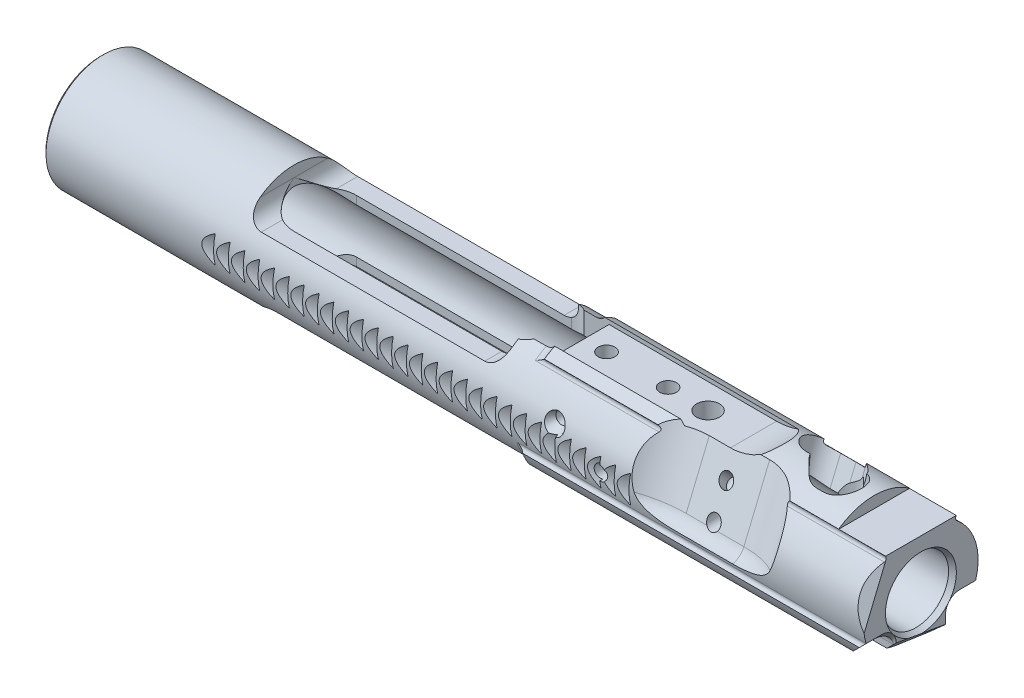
SolidWorks part; units mm, degrees
ref_plane "Front Plane" through (0, 0, 0) normal (0, 0, 1) x (1, 0, 0)
ref_plane "Top Plane" through (0, 0, 0) normal (0, 1, 0) x (1, 0, 0)
ref_plane "Right Plane" through (0, 0, 0) normal (1, 0, 0) x (0, 0, -1)
sketch "Sketch1" plane through (0, 0, 0) normal (1, 0, 0) x (0, 0, -1)
  circle A0 centre (0, 0) radius 11.7983
  dimension "D1" = 23.5966
extrude "Boss-Extrude1" add sketch "Sketch1" against normal blind 169.164
sketch "Sketch2" plane through (-169.164, 0, 0) normal (-1, 0, 0) x (0, 0, 1)
  circle A0 centre (0, 0) radius 7.9375
  dimension "D1" = 15.875
extrude "Cut-Extrude1" cut sketch "Sketch2" against normal blind 97.917
fillet "Fillet1" radius 1.5875 1 edges at (-71.247, 0, 7.9375)
sketch "Sketch3" plane through (0, 0, 0) normal (0, 0, 1) x (1, 0, 0)
  line L0 (-80.01, 6.35) -> (-126.111, 6.35)
  line L1 (-129.286, 9.525) -> (-129.286, 11.7983)
  line L2 (0, 11.7983) -> (-169.164, 11.7983) construction
  line L3 (-129.286, 11.7983) -> (-76.835, 11.7983)
  line L4 (-76.835, 11.7983) -> (-76.835, 9.525)
  line L5 (-169.164, 11.7983) -> (-169.164, -11.7983) construction
  line L6 (-169.164, -11.7983) -> (0, -11.7983) construction
  line L7 (-122.3462, -6.35) -> (-71.298, -6.35)
  line L8 (-71.298, -6.35) -> (-71.298, -11.7983)
  line L9 (-71.298, -11.7983) -> (-129.286, -11.7983)
  arc A0 (-126.111, 6.35) -> (-129.286, 9.525) centre (-126.111, 9.525) cw
  arc A1 (-80.01, 6.35) -> (-76.835, 9.525) centre (-80.01, 9.525) ccw
  arc A2 (-122.3462, -6.35) -> (-129.286, -11.7983) centre (-122.3462, -13.494) ccw
  dimension "D4" = 3.175
  dimension "D7" = 14.288
  dimension "D1" = 6.35
  dimension "D2" = 39.878
  dimension "D3" = 52.451
  dimension "D6" = 6.35
  dimension "D8" = 97.866
extrude "Cut-Extrude2" cut sketch "Sketch3" against normal mid plane 30
sketch "Sketch4" plane through (0, 6.35, 0) normal (0, 1, 0) x (1, 0, 0)
  line L0 (-136.4041, 0) -> (-71.6825, 0) construction
  line L1 (-129.286, -6.9623) -> (-129.286, 6.9623) construction
  line L3 (-122.8545, 6.4315) -> (-78.473, 6.4315)
  line L4 (-122.8545, -6.4315) -> (-78.473, -6.4315)
  line L5 (-169.164, 11.7983) -> (-169.164, -11.7983) construction
  arc A0 (-122.8545, 6.4315) -> (-122.8545, -6.4315) centre (-122.8545, 0) ccw
  arc A1 (-78.473, -6.4315) -> (-78.473, 6.4315) centre (-78.473, 0) ccw
  dimension "D1" = 12.863
  dimension "D2" = 12.863
  dimension "D3" = 90.691
extrude "Cut-Extrude3" cut sketch "Sketch4" against normal up to next and the other way up to next
sketch "Sketch5" plane through (0, -6.35, 0) normal (0, -1, 0) x (1, 0, 0)
  line L0 (-169.164, 0) -> (-116.3804, 0) construction
  line L1 (-169.164, 11.7983) -> (-169.164, -11.7983) construction
  line L2 (-129.286, 0) -> (-129.286, 4.226) construction
  line L3 (-122.8545, 6.4315) -> (-78.1436, 6.4315)
  line L4 (-78.1436, 6.4315) -> (-78.1436, -6.4315)
  line L5 (-78.1436, -6.4315) -> (-122.8545, -6.4315)
  arc A0 (-122.8545, 6.4315) -> (-122.8545, -6.4315) centre (-122.8545, 0) ccw
  spline S0 degree 3 poles (-122.3462, 9.9437) (-122.9959, 9.9437) (-123.6281, 9.8897) (-124.5504, 9.718) (-124.8481, 9.646) (-125.4159, 9.4721) (-125.6874, 9.3698) (-126.2059, 9.1303) (-126.4505, 8.9936) (-126.9004, 8.6908) (-127.1077, 8.5238) (-127.4897, 8.1561) (-127.6639, 7.9553) (-127.9739, 7.5305) (-128.1113, 7.3052) (-128.3563, 6.8285) (-128.4643, 6.5758) (-128.6514, 6.0562) (-128.7312, 5.7883) (-128.8695, 5.2369) (-128.9279, 4.9535) (-129.0282, 4.3715) (-129.0701, 4.0716) (-129.1752, 3.1611) (-129.2184, 2.5411) (-129.274, 1.2768) (-129.2861, 0.6287) (-129.2859, -0.6503) (-129.2737, -1.2858) (-129.2318, -2.233) (-129.2137, -2.5489) (-129.1671, -3.1727) (-129.1387, -3.4788) (-129.0343, -4.3794) (-128.9395, -4.9566) (-128.7322, -5.7849) (-128.6515, -6.056) (-128.4633, -6.5786) (-128.3566, -6.8279) (-128.1128, -7.3025) (-127.9758, -7.5278) (-127.665, -7.9541) (-127.4902, -8.1555) (-126.9207, -8.7042) (-126.4769, -9.004) (-125.4341, -9.4879) (-124.8667, -9.6584) (-123.9464, -9.8308) (-123.6295, -9.8735) (-122.9934, -9.9297) (-122.6716, -9.9437) (-122.3462, -9.9437) knots 0 0 0 0 0.0625 0.0625 0.09375 0.09375 0.125 0.125 0.15625 0.15625 0.1875 0.1875 0.21875 0.21875 0.25 0.25 0.28125 0.28125 0.3125 0.3125 0.34375 0.34375 0.375 0.375 0.4375 0.4375 0.5 0.5 0.5625 0.5625 0.59375 0.59375 0.625 0.625 0.6875 0.6875 0.71875 0.71875 0.75 0.75 0.78125 0.78125 0.8125 0.8125 0.875 0.875 0.9375 0.9375 0.96875 0.96875 1 1 1 1 construction
  dimension "D2" = 12.863
extrude "Cut-Extrude4" cut sketch "Sketch5" against normal up to next and the other way up to next
sketch "Sketch6" plane through (-169.164, 0, 0) normal (-1, 0, 0) x (0, 0, 1)
  line L0 (0, 0) -> (0, -11.7983) construction
  line L1 (-1.9939, -8.8159) -> (1.9939, -8.8159)
  line L2 (-1.9939, -8.8159) -> (-1.9939, -10.9859)
  line L3 (-1.9939, -13.3258) -> (1.9939, -13.3258)
  line L4 (1.9939, -10.9859) -> (1.9939, -8.8159)
  line L5 (-1.9939, -10.9859) -> (-2.9111, -11.9031)
  line L6 (-2.9111, -11.9031) -> (-2.9111, -13.3258)
  line L7 (-2.9111, -13.3258) -> (-1.9939, -13.3258)
  line L8 (1.9939, -10.9859) -> (2.9111, -11.9031)
  line L9 (2.9111, -11.9031) -> (2.9111, -13.3258)
  line L10 (2.9111, -13.3258) -> (1.9939, -13.3258)
  circle A0 centre (0, 0) radius 11.7983 construction
  point P9 (0, -8.8159)
  dimension "D1" = 8.8159
  dimension "D2" = 3.9878
  dimension "D3" = 2.17
extrude "Cut-Extrude5" cut sketch "Sketch6" against normal up to next
chamfer "Chamfer1" distance 0.508 1 edges at (-169.164, 11.7983, 0)
sketch "Sketch9" plane through (0, 0, 0) normal (0, 0, 1) x (1, 0, 0)
  line L0 (0, 0) -> (-71.247, 0) construction
  line L1 (-71.247, 6.35) -> (-71.247, -6.35) construction
  line L2 (-1.016, 6.731) -> (-29.845, 6.731)
  line L3 (-1.016, 6.731) -> (0, 7.3176)
  line L4 (0, -11.7983) -> (0, 11.7983) construction
  line L5 (-30.5049, 6.35) -> (-42.634, 6.35)
  line L6 (-30.5049, 6.35) -> (-29.845, 6.731)
  line L7 (-45.174, 6.35) -> (-46.863, 6.35)
  line L8 (-46.863, 6.35) -> (-46.863, 3.1877)
  line L9 (-46.863, 3.1877) -> (-49.6062, 3.1877)
  line L10 (-49.6062, 3.1877) -> (-49.6062, 3.7465)
  line L11 (-49.6062, 3.7465) -> (-57.4, 3.7465)
  line L12 (-57.4, 3.7465) -> (-57.4, 5.588)
  line L13 (-57.4, 5.588) -> (-71.247, 5.588)
  line L14 (-71.247, 5.588) -> (-71.247, 0)
  line L15 (0, 7.3176) -> (0, 0)
  line L16 (0, 0) -> (-71.247, 0)
  arc A0 (-42.634, 6.35) -> (-45.174, 6.35) centre (-43.904, 6.35) ccw
  dimension "D8" = 2.54
  dimension "D9" = 2.959
  dimension "D1" = 13.462
  dimension "D2" = 30
  dimension "D3" = 1.016
  dimension "D4" = 29.845
  dimension "D5" = 12.7
  dimension "D6" = 30
  dimension "D7" = 46.863
  dimension "D10" = 6.3754
  dimension "D11" = 2.7432
  dimension "D12" = 7.493
  dimension "D13" = 57.4
  dimension "D14" = 11.176
revolve "Cut-Revolve1" cut sketch "Sketch9" angle 360 about L0
sketch "Sketch12" plane through (0, 0, 0) normal (1, 0, 0) x (0, 0, -1)
  line L0 (0, 0) -> (0, 12.5603) construction
  line L1 (0, 0) -> (-7.9164, 9.7515) construction
  line L2 (0, 0) -> (-12.0179, -3.6513) construction
  arc A1 (-11.7743, -4.3733) -> (11.7743, -4.3733) centre (0, 0) ccw
  arc A2 (-11.2888, -3.4298) -> (11.2888, -3.4298) centre (0, 0) ccw
  arc A3 (-7.4361, 9.1599) -> (-7.3105, 10.2136) centre (-7.9164, 9.7515) ccw
  arc A4 (-11.7743, -4.3733) -> (-11.2888, -3.4298) centre (-12.0179, -3.6513) ccw
  circle A5 centre (0, 0) radius 11.7983 construction
  arc A6 (11.7743, -4.3733) -> (11.2888, -3.4298) centre (12.0179, -3.6513) cw
  arc A7 (7.4361, 9.1599) -> (7.3105, 10.2136) centre (7.9164, 9.7515) cw
  arc A8 (7.3105, 10.2136) -> (-7.3105, 10.2136) centre (0, 0) ccw
  arc A9 (7.4361, 9.1599) -> (-7.4361, 9.1599) centre (0, 0) ccw
  dimension "D3" = 1.524
  dimension "D1" = 39.07
  dimension "D2" = 106.9
extrude "Boss-Extrude2" add sketch "Sketch12" against normal blind 72.0921
sketch "Sketch13" plane through (0, 0, 0) normal (0, 0, 1) x (1, 0, 0)
  line L0 (0, 12.5603) -> (-70.358, 12.5603) construction
  line L1 (0, 12.5603) -> (-72.0921, 12.5603) construction
  line L3 (-129.286, 11.7983) -> (-72.0921, 11.7983) construction
  line L4 (0, 0) -> (-62.44, 0) construction
  line L6 (-129.286, 9.525) -> (-129.286, 11.7983) construction
  circle A0 centre (-72.0921, 14.1525) radius 2.3542
  dimension "D1" = 70.358
revolve "Cut-Revolve2" cut sketch "Sketch13" angle 360 about L4
sketch "Sketch10" plane through (0, 0, 0) normal (0, 0, 1) x (1, 0, 0)
  line L0 (-34.925, 10.617) -> (-69.4692, 10.617)
  line L1 (-75.782, 17.653) -> (-47.625, 23.317)
  arc A0 (-75.782, 17.653) -> (-69.4692, 10.617) centre (-75.782, 11.303) ccw
  arc A1 (-34.925, 10.617) -> (-47.625, 23.317) centre (-34.925, 23.317) ccw
  dimension "D1" = 12.7
  dimension "D4" = 25.4
  dimension "D2" = 75.782
  dimension "D3" = 11.303
  dimension "D5" = 23.317
  dimension "D6" = 34.925
extrude "Cut-Extrude8" cut sketch "Sketch10" against normal mid plane 10.3124
sketch "Sketch14" plane through (0, 0, 0) normal (1, 0, 0) x (0, 0, -1)
  line L0 (-7.29, 10.1854) -> (7.29, 10.1854)
  arc A0 (7.3105, 10.2136) -> (-7.3105, 10.2136) centre (0, 0) ccw construction
  arc A1 (7.3105, 10.2136) -> (-7.3105, 10.2136) centre (0, 0) ccw
  arc A2 (-7.4361, 9.1599) -> (-7.3105, 10.2136) centre (-7.9164, 9.7515) ccw construction
  arc A3 (-7.29, 10.1854) -> (-7.3105, 10.2136) centre (-7.9164, 9.7515) ccw
  arc A4 (7.3105, 10.2136) -> (7.4361, 9.1599) centre (7.9164, 9.7515) ccw construction
  arc A5 (7.3105, 10.2136) -> (7.29, 10.1854) centre (7.9164, 9.7515) ccw
  dimension "D1" = 10.1854
extrude "Cut-Extrude9" cut sketch "Sketch14" against normal blind 9.652
sketch "Sketch15" plane through (0, 0, 0) normal (1, 0, 0) x (0, 0, -1)
  line L0 (0, 0) -> (0, -12.5603) construction
  line L1 (0, 0) -> (-7.0649, -6.9865) construction
  line L2 (-8.1505, -5.3252) -> (-10.5149, -6.8701)
  line L3 (2.858, -9.246) -> (-2.858, -9.246)
  line L4 (-5.0804, -6.9865) -> (-5.0804, -8.3254)
  line L5 (-5.0804, -8.3254) -> (-2.858, -9.246)
  line L6 (5.0804, -8.3254) -> (2.858, -9.246)
  line L7 (5.0804, -6.9865) -> (5.0804, -8.3254)
  line L8 (8.1505, -5.3252) -> (10.5149, -6.8701)
  arc A0 (-11.7743, -4.3733) -> (11.7743, -4.3733) centre (0, 0) ccw construction
  arc A1 (-5.0804, -6.9865) -> (-8.1505, -5.3252) centre (-7.0649, -6.9865) ccw
  arc A2 (-10.5149, -6.8701) -> (10.5149, -6.8701) centre (0, 0) ccw
  arc A3 (5.0804, -6.9865) -> (8.1505, -5.3252) centre (7.0649, -6.9865) cw
  point P15 (0, -9.246)
  dimension "D3" = 3.969
  dimension "D1" = 45.32
  dimension "D2" = 9.936
  dimension "D4" = 5.0804
  dimension "D5" = 2.858
  dimension "D6" = 22.5
  dimension "D7" = 9.246
extrude "Cut-Extrude10" cut sketch "Sketch15" against normal blind 71.2978
sketch "Sketch17" plane through (0, 0, 0) normal (1, 0, 0) x (0, 0, -1)
  line L0 (-2.2866, -6.35) -> (-9.9437, -6.35) construction
  line L1 (9.9437, -6.35) -> (2.2866, -6.35) construction
  line L3 (-5.0804, -8.3254) -> (-5.0804, -6.9865) construction
  line L4 (-2.858, -9.246) -> (-5.0804, -8.3254) construction
  line L5 (2.858, -9.246) -> (-2.858, -9.246) construction
  line L6 (5.0804, -8.3254) -> (2.858, -9.246) construction
  line L7 (5.0804, -6.9865) -> (5.0804, -8.3254) construction
  line L9 (-5.1853, -6.35) -> (-9.7188, -6.35)
  line L10 (9.7188, -6.35) -> (5.1853, -6.35)
  line L12 (-5.0804, -8.3254) -> (-5.0804, -6.9865)
  line L13 (-2.858, -9.246) -> (-5.0804, -8.3254)
  line L14 (2.858, -9.246) -> (-2.858, -9.246)
  line L15 (5.0804, -8.3254) -> (2.858, -9.246)
  line L16 (5.0804, -6.9865) -> (5.0804, -8.3254)
  line L17 (-8.1505, -5.3252) -> (-10.5149, -6.8701) construction
  line L18 (-9.7188, -6.35) -> (-9.9925, -6.5288)
  line L19 (9.9925, -6.5288) -> (8.1505, -5.3252) construction
  line L20 (9.9925, -6.5288) -> (9.7188, -6.35)
  arc A0 (-5.0804, -6.9865) -> (-8.1505, -5.3252) centre (-7.0649, -6.9865) ccw construction
  arc A1 (8.1505, -5.3252) -> (5.0804, -6.9865) centre (7.0649, -6.9865) ccw construction
  arc A2 (-9.9925, -6.5288) -> (9.9925, -6.5288) centre (0, 0) ccw construction
  arc A3 (-5.0804, -6.9865) -> (-5.1853, -6.35) centre (-7.0649, -6.9865) ccw
  arc A4 (5.1853, -6.35) -> (5.0804, -6.9865) centre (7.0649, -6.9865) ccw
  arc A5 (-9.9925, -6.5288) -> (9.9925, -6.5288) centre (0, 0) ccw
extrude "Cut-Extrude11" cut sketch "Sketch17" against normal blind 81.2978
sketch "Sketch18" plane through (-71.2978, 0, 0) normal (1, 0, 0) x (0, 0, -1)
  line L2 (5.1853, -6.35) -> (9.7188, -6.35)
  line L3 (9.7188, -6.35) -> (8.1505, -5.3252)
  line L4 (5.1853, -6.35) -> (9.7188, -6.35)
  line L5 (9.7188, -6.35) -> (8.1505, -5.3252)
  arc A3 (8.1505, -5.3252) -> (5.1853, -6.35) centre (7.0649, -6.9865) ccw
  arc A5 (8.1505, -5.3252) -> (5.1853, -6.35) centre (7.0649, -6.9865) ccw
  dimension "D1" = 0
ref_plane "Plane1" through (0, 0, -7.0649) normal (0, 0, 1) x (1, 0, 0)
sketch "Sketch19" plane through (0, 0, -7.0649) normal (0, 0, 1) x (1, 0, 0)
  line L0 (-71.2978, -49.6068) -> (-71.2978, -5.002) construction
  line L1 (-71.2978, -49.6068) -> (-94.0311, -11.2298) construction
  arc A0 (-71.2978, -5.002) -> (-94.0311, -11.2298) centre (-71.2978, -49.6068) ccw
  dimension "D1" = 89.2097
sweep "Cut-Sweep1" cut profiles "Sketch18" path "Sketch19"
mirror "Mirror1" about plane through (0, 0, 0) normal (0, 0, 1) of "Cut-Sweep1"
sketch "Sketch20" plane through (0, 0, 0) normal (0, 0, 1) x (1, 0, 0)
  line L0 (-72.0921, -6.35) -> (-122.3462, -6.35) construction
  line L1 (-71.298, -9.246) -> (-73.2608, -9.246)
  line L2 (-71.298, -9.246) -> (-71.298, -6.35)
  line L3 (-71.298, -6.35) -> (-73.2608, -6.35)
  line L4 (-73.2608, -9.246) -> (-73.2608, -6.35)
extrude "Cut-Extrude12" cut sketch "Sketch20" against normal up to next and the other way up to next
sketch "Sketch22" plane through (0, 0, 0) normal (0, 1, 0) x (1, 0, 0)
  line L0 (-118.1731, 0) -> (-60.3792, 0) construction
  line L1 (-71.247, 5.588) -> (-71.247, -5.588) construction
  line L2 (-71.247, 5.583) -> (-71.247, -5.583)
  line L3 (-78.4735, -6.4315) -> (-73.0446, -7.1565)
  line L4 (-78.1436, -6.4315) -> (-81.7584, -6.4315) construction
  line L5 (-78.4735, -6.4315) -> (-78.4735, 6.4315)
  line L6 (-78.4735, 6.4315) -> (-73.0446, 7.1565)
  arc A0 (-73.0446, -7.1565) -> (-71.247, -5.583) centre (-72.8345, -5.583) ccw
  arc A1 (-73.0446, 7.1565) -> (-71.247, 5.583) centre (-72.8345, 5.583) cw
  point P13 (-71.247, 0)
  point P17 (-78.4735, 0)
  dimension "D1" = 3.175
  dimension "D2" = 5.583
  dimension "D3" = 5.639
extrude "Cut-Extrude13" cut sketch "Sketch22" against normal up to surface (6.35 mm away)
sketch "Sketch24" plane through (0, 0, 0) normal (0, 0, 1) x (1, 0, 0)
  line L0 (-43.307, -9.246) -> (-71.298, -8.3254)
  line L1 (-71.298, -8.3254) -> (-71.298, -9.246)
  line L2 (-71.298, -9.246) -> (-43.307, -9.246)
  line L3 (-71.298, -9.246) -> (0, -9.246) construction
  line L4 (-71.298, -8.3254) -> (-71.298, -6.9865) construction
  dimension "D2" = 43.307
extrude "Cut-Extrude15" cut sketch "Sketch24" against normal up to next and the other way up to next
sketch "Sketch25" plane through (0, 0, 0) normal (1, 0, 0) x (0, 0, -1)
  line L0 (-11.2887, -3.43) -> (11.2887, -3.43) construction
  arc A0 (-7.4361, 9.1599) -> (-11.2888, -3.4298) centre (0, 0) ccw construction
  arc A1 (11.2888, -3.4298) -> (7.4361, 9.1599) centre (0, 0) ccw construction
  dimension "D1" = 3.43
ref_plane "Plane2" through (-1.715, -1.715, 0) normal (0.7071, 0.7071, 0) x (-0.7071, 0.7071, 0)
sketch "Sketch27" plane through (-1.715, -1.715, 0) normal (0.7071, 0.7071, 0) x (-0.7071, 0.7071, 0)
  line L0 (-2.4254, 11.2887) -> (-2.4254, -11.2887) construction
  line L1 (-4.9402, -5.0804) -> (-5.887, -5.0804) construction
  line L2 (-4.5319, -5.0804) -> (-5.7795, -5.0804)
  line L3 (-2.4254, -8.059) -> (-2.4254, -11.7743)
  line L4 (46.6582, -11.7743) -> (-3.0924, -11.7743) construction
  line L5 (-2.4254, -11.7743) -> (-6.6384, -11.7743)
  line L6 (-6.6384, -11.7743) -> (-6.6384, -5.0804)
  line L7 (0, 0) -> (-14.9346, 0) construction
  line L8 (-2.4254, 11.7743) -> (-6.6384, 11.7743)
  line L9 (-2.4254, 8.059) -> (-2.4254, 11.7743)
  line L11 (-6.6384, 11.7743) -> (-6.6384, 5.0804)
  line L12 (-4.5319, 5.0804) -> (-5.7795, -5.0804)
  line L13 (-6.6384, 5.0804) -> (-6.6384, -5.0804)
  ellipse E0 centre (-4.5319, -8.059) end of major axis (-4.5319, -5.0804) minor radius 2.1065 (-2.4254, -8.059) -> (-4.5319, -5.0804) ccw
  ellipse E1 centre (-4.5319, 8.059) end of major axis (-4.5319, 5.0804) minor radius 2.1065 (-2.4254, 8.059) -> (-4.5319, 5.0804) cw
  dimension "D1" = 8.059
  dimension "D2" = 4.213
  dimension "D3" = 7
extrude "Cut-Extrude17" cut sketch "Sketch27" against normal blind 8.3566
sketch "Sketch28" plane through (0, 0, 0) normal (1, 0, 0) x (0, 0, -1)
  line L0 (0, 0) -> (0, 9.2596) construction
  line L1 (-12.197, -2.5741) -> (-7.2124, 9.4599)
  arc A0 (-7.4361, 9.1599) -> (-7.29, 10.1854) centre (-7.9164, 9.7515) ccw construction
  dimension "D1" = 22.5
ref_plane "Plane3" through (0, 9.4599, 0) normal (0, 1, 0) x (-1, 0, 0)
sketch "Sketch31" plane through (0, 9.4599, 0) normal (0, 1, 0) x (-1, 0, 0)
  line L0 (0, 7.2124) -> (5, 12.2124)
  line L1 (5, 12.2124) -> (0, 12.2124)
  line L2 (0, 12.2124) -> (0, 7.2124)
  dimension "D1" = 45
  dimension "D2" = 5
sweep "Cut-Sweep2" cut profiles "Sketch31" path "Sketch28"
ref_plane "Plane4" through (-27.388, 0, 0) normal (1, 0, 0) x (0, 0, -1)
sketch "Sketch32" plane through (-27.388, 0, 0) normal (1, 0, 0) x (0, 0, -1)
  line L0 (-9.1211, -0.891) -> (-3.7922, 11.9742)
  line L1 (0, 0) -> (0, 9.0623) construction
  line L2 (-9.1211, -0.891) -> (-14.1082, 1.1747) construction
  line L3 (-12.0544, 0.324) -> (-13.2694, -2.6093) construction
  arc A0 (-13.2694, -2.6093) -> (-9.1211, -0.891) centre (-12.0544, 0.324) ccw
  arc A1 (7.3105, 10.2136) -> (-7.3105, 10.2136) centre (0, 0) ccw construction
  arc A2 (7.3105, 10.2136) -> (-7.3105, 10.2136) centre (0, 0) ccw construction
  dimension "D4" = 6.35
  dimension "D1" = 22.5
  dimension "D2" = 9.1211
  dimension "D3" = 0.891
ref_plane "Plane5" through (-27.388, 11.9742, 3.7922) normal (0, 0.9239, -0.3827) x (-1, 0, 0)
sketch "Sketch33" plane through (-27.388, 11.9742, 3.7922) normal (0, 0.9239, -0.3827) x (-1, 0, 0)
  line L0 (0, 0) -> (11.899, 0)
  line L1 (-8.9803, 3.7197) -> (20.8793, 3.7197)
  arc A0 (-8.9803, 3.7197) -> (0, 0) centre (0, 12.7) ccw
  arc A1 (11.899, 0) -> (20.8793, 3.7197) centre (11.899, 12.7) ccw
  dimension "D1" = 25.4
  dimension "D2" = 25.4
  dimension "D3" = 11.899
sweep "Cut-Sweep4" cut profiles "Sketch33" path "Sketch32"
fillet "Fillet2" radius 2 1 edges at (-71.298, -8.3254, 0)
sketch "Sketch34" plane through (0, 10.617, 0) normal (0, 1, 0) x (1, 0, 0)
  line L0 (0, 0) -> (-69.4692, 0) construction
  line L1 (-69.4692, 5.1562) -> (-69.4692, -5.1562) construction
  circle A0 centre (-43.9039, 0) radius 2.3749
  dimension "D1" = 4.7498
  dimension "D2" = 43.9039
extrude "Cut-Extrude18" cut sketch "Sketch34" against normal up to next
ref_plane "Plane6" through (-64.2747, 0, 0) normal (1, 0, 0) x (0, 0, -1)
sketch "Sketch35" plane through (-64.2747, 0, 0) normal (1, 0, 0) x (0, 0, -1)
  line L0 (0, 0) -> (0, 10.617) construction
  line L2 (-11.8825, 3.9692) -> (11.8825, 3.9692) construction
  line L3 (5.1562, 10.617) -> (-5.1562, 10.617) construction
  line L4 (-9.7907, 5.2011) -> (0, 5.2011)
  line L5 (-9.7907, 5.2011) -> (-11.8825, 6.4088)
  line L6 (-11.8825, 3.9692) -> (-11.8825, 6.4088)
  line L7 (0, 5.2011) -> (6.6656, 5.2011)
  line L8 (6.6656, 5.2011) -> (10.7351, 7.5506)
  line L9 (11.8825, 7.5506) -> (11.8825, 3.9692)
  line L10 (10.7351, 7.5506) -> (11.8825, 7.5506)
  line L11 (11.8825, 3.9692) -> (-11.8825, 3.9692)
  point P10 (0, 3.9692)
  dimension "D1" = 6.6478
  dimension "D2" = 2.4638
  dimension "D3" = 9.7907
  dimension "D4" = 30
  dimension "D5" = 30
  dimension "D6" = 6.6656
  dimension "D7" = 7.1628
revolve "Cut-Revolve3" cut sketch "Sketch35" angle 360 about L11
sketch "Sketch36" plane through (0, 0, 0) normal (0, 0, 1) x (1, 0, 0)
  circle A0 centre (-54.5211, 0) radius 1.4351
  circle A1 centre (-33.9344, 0) radius 1.397
  dimension "D1" = 2.8702
  dimension "D2" = 54.5211
  dimension "D3" = 2.794
  dimension "D4" = 33.9344
extrude "Cut-Extrude19" cut sketch "Sketch36" along normal up to next
ref_plane "Plane7" through (-33.9344, 0, 0) normal (1, 0, 0) x (0, 0, -1)
sketch "Sketch37" plane through (-33.9344, 0, 0) normal (1, 0, 0) x (0, 0, -1)
  line L0 (0, 0) -> (-8.0365, 0) construction
  line L1 (0, 0) -> (-7.7756, 7.7756) construction
  line L2 (-7.7756, 7.7756) -> (-6.7878, 8.7634)
  line L3 (-6.7878, 8.7634) -> (-2.0988, 4.0744)
  line L4 (-2.0988, 4.0744) -> (-3.0866, 3.0866)
  line L5 (-7.7756, 7.7756) -> (-3.0866, 3.0866)
  dimension "D1" = 45
  dimension "D2" = 2.794
revolve "Cut-Revolve4" cut sketch "Sketch37" angle 360 about L1
sketch "Sketch38" plane through (0, 0, 0) normal (0, 1, 0) x (1, 0, 0)
  line L0 (0, 0) -> (-126.9169, 0) construction
  line L1 (-136.5261, -18.8523) -> (-134.0988, -18.8523)
  line L2 (0, -18.8523) -> (-162.5946, -18.8523) construction
  line L3 (-136.5261, -18.8523) -> (-136.5261, -11.7983)
  line L4 (-134.0988, -18.8523) -> (-134.0988, -10.9148)
  line L5 (-134.0988, -10.9148) -> (-136.5261, -11.7983)
  line L6 (-133.4661, -18.8523) -> (-133.4661, -11.7983)
  line L7 (-131.0388, -10.9148) -> (-133.4661, -11.7983)
  line L8 (-131.0388, -18.8523) -> (-131.0388, -10.9148)
  line L9 (-133.4661, -18.8523) -> (-131.0388, -18.8523)
  line L10 (-130.4061, -18.8523) -> (-130.4061, -11.7983)
  line L11 (-127.9788, -10.9148) -> (-130.4061, -11.7983)
  line L12 (-127.9788, -18.8523) -> (-127.9788, -10.9148)
  line L13 (-130.4061, -18.8523) -> (-127.9788, -18.8523)
  line L14 (-127.3461, -18.8523) -> (-127.3461, -11.7983)
  line L15 (-124.9188, -10.9148) -> (-127.3461, -11.7983)
  line L16 (-124.9188, -18.8523) -> (-124.9188, -10.9148)
  line L17 (-127.3461, -18.8523) -> (-124.9188, -18.8523)
  line L18 (-124.2861, -18.8523) -> (-124.2861, -11.7983)
  line L19 (-121.8588, -10.9148) -> (-124.2861, -11.7983)
  line L20 (-121.8588, -18.8523) -> (-121.8588, -10.9148)
  line L21 (-124.2861, -18.8523) -> (-121.8588, -18.8523)
  line L22 (-121.2261, -18.8523) -> (-121.2261, -11.7983)
  line L23 (-118.7988, -10.9148) -> (-121.2261, -11.7983)
  line L24 (-118.7988, -18.8523) -> (-118.7988, -10.9148)
  line L25 (-121.2261, -18.8523) -> (-118.7988, -18.8523)
  line L26 (-118.1661, -18.8523) -> (-118.1661, -11.7983)
  line L27 (-115.7388, -10.9148) -> (-118.1661, -11.7983)
  line L28 (-115.7388, -18.8523) -> (-115.7388, -10.9148)
  line L29 (-118.1661, -18.8523) -> (-115.7388, -18.8523)
  line L30 (-115.1061, -18.8523) -> (-115.1061, -11.7983)
  line L31 (-112.6788, -10.9148) -> (-115.1061, -11.7983)
  line L32 (-112.6788, -18.8523) -> (-112.6788, -10.9148)
  line L33 (-115.1061, -18.8523) -> (-112.6788, -18.8523)
  line L34 (-112.0461, -18.8523) -> (-112.0461, -11.7983)
  line L35 (-109.6188, -10.9148) -> (-112.0461, -11.7983)
  line L36 (-109.6188, -18.8523) -> (-109.6188, -10.9148)
  line L37 (-112.0461, -18.8523) -> (-109.6188, -18.8523)
  line L38 (-108.9861, -18.8523) -> (-108.9861, -11.7983)
  line L39 (-106.5588, -10.9148) -> (-108.9861, -11.7983)
  line L40 (-106.5588, -18.8523) -> (-106.5588, -10.9148)
  line L41 (-108.9861, -18.8523) -> (-106.5588, -18.8523)
  line L42 (-105.9261, -18.8523) -> (-105.9261, -11.7983)
  line L43 (-103.4988, -10.9148) -> (-105.9261, -11.7983)
  line L44 (-103.4988, -18.8523) -> (-103.4988, -10.9148)
  line L45 (-105.9261, -18.8523) -> (-103.4988, -18.8523)
  line L46 (-102.8661, -18.8523) -> (-102.8661, -11.7983)
  line L47 (-100.4388, -10.9148) -> (-102.8661, -11.7983)
  line L48 (-100.4388, -18.8523) -> (-100.4388, -10.9148)
  line L49 (-102.8661, -18.8523) -> (-100.4388, -18.8523)
  line L50 (-99.8061, -18.8523) -> (-99.8061, -11.7983)
  line L51 (-97.3788, -10.9148) -> (-99.8061, -11.7983)
  line L52 (-97.3788, -18.8523) -> (-97.3788, -10.9148)
  line L53 (-99.8061, -18.8523) -> (-97.3788, -18.8523)
  line L54 (-96.7461, -18.8523) -> (-96.7461, -11.7983)
  line L55 (-94.3188, -10.9148) -> (-96.7461, -11.7983)
  line L56 (-94.3188, -18.8523) -> (-94.3188, -10.9148)
  line L57 (-96.7461, -18.8523) -> (-94.3188, -18.8523)
  line L58 (-93.6861, -18.8523) -> (-93.6861, -11.7983)
  line L59 (-91.2588, -10.9148) -> (-93.6861, -11.7983)
  line L60 (-91.2588, -18.8523) -> (-91.2588, -10.9148)
  line L61 (-93.6861, -18.8523) -> (-91.2588, -18.8523)
  line L62 (-90.6261, -18.8523) -> (-90.6261, -11.7983)
  line L63 (-88.1988, -10.9148) -> (-90.6261, -11.7983)
  line L64 (-88.1988, -18.8523) -> (-88.1988, -10.9148)
  line L65 (-90.6261, -18.8523) -> (-88.1988, -18.8523)
  line L66 (-87.5661, -18.8523) -> (-87.5661, -11.7983)
  line L67 (-85.1388, -10.9148) -> (-87.5661, -11.7983)
  line L68 (-85.1388, -18.8523) -> (-85.1388, -10.9148)
  line L69 (-87.5661, -18.8523) -> (-85.1388, -18.8523)
  line L70 (-84.5061, -18.8523) -> (-84.5061, -11.7983)
  line L71 (-82.0788, -10.9148) -> (-84.5061, -11.7983)
  line L72 (-82.0788, -18.8523) -> (-82.0788, -10.9148)
  line L73 (-84.5061, -18.8523) -> (-82.0788, -18.8523)
  line L74 (-81.4461, -18.8523) -> (-81.4461, -11.7983)
  line L75 (-79.0188, -10.9148) -> (-81.4461, -11.7983)
  line L76 (-79.0188, -18.8523) -> (-79.0188, -10.9148)
  line L77 (-81.4461, -18.8523) -> (-79.0188, -18.8523)
  line L78 (-78.3861, -18.8523) -> (-78.3861, -11.7983)
  line L79 (-75.9588, -10.9148) -> (-78.3861, -11.7983)
  line L80 (-75.9588, -18.8523) -> (-75.9588, -10.9148)
  line L81 (-78.3861, -18.8523) -> (-75.9588, -18.8523)
  line L82 (-75.3261, -18.8523) -> (-75.3261, -11.7983)
  line L83 (-72.8988, -10.9148) -> (-75.3261, -11.7983)
  line L84 (-72.8988, -18.8523) -> (-72.8988, -10.9148)
  line L85 (-75.3261, -18.8523) -> (-72.8988, -18.8523)
  line L86 (-72.2661, -18.8523) -> (-72.2661, -11.7983)
  line L87 (-69.8388, -10.9148) -> (-72.2661, -11.7983)
  line L88 (-69.8388, -18.8523) -> (-69.8388, -10.9148)
  line L89 (-72.2661, -18.8523) -> (-69.8388, -18.8523)
  line L90 (-69.2061, -18.8523) -> (-69.2061, -11.7983)
  line L91 (-66.7788, -10.9148) -> (-69.2061, -11.7983)
  line L92 (-66.7788, -18.8523) -> (-66.7788, -10.9148)
  line L93 (-69.2061, -18.8523) -> (-66.7788, -18.8523)
  line L94 (-66.1461, -18.8523) -> (-66.1461, -11.7983)
  line L95 (-63.7188, -10.9148) -> (-66.1461, -11.7983)
  line L96 (-63.7188, -18.8523) -> (-63.7188, -10.9148)
  line L97 (-66.1461, -18.8523) -> (-63.7188, -18.8523)
  line L98 (-63.0861, -18.8523) -> (-63.0861, -11.7983)
  line L99 (-60.6588, -10.9148) -> (-63.0861, -11.7983)
  line L100 (-60.6588, -18.8523) -> (-60.6588, -10.9148)
  line L101 (-63.0861, -18.8523) -> (-60.6588, -18.8523)
  line L102 (-60.0261, -18.8523) -> (-60.0261, -11.7983)
  line L103 (-57.5988, -10.9148) -> (-60.0261, -11.7983)
  line L104 (-57.5988, -18.8523) -> (-57.5988, -10.9148)
  line L105 (-60.0261, -18.8523) -> (-57.5988, -18.8523)
  line L106 (-56.9661, -18.8523) -> (-56.9661, -11.7983)
  line L107 (-54.5388, -10.9148) -> (-56.9661, -11.7983)
  line L108 (-54.5388, -18.8523) -> (-54.5388, -10.9148)
  line L109 (-56.9661, -18.8523) -> (-54.5388, -18.8523)
  line L110 (-53.9061, -18.8523) -> (-53.9061, -11.7983)
  line L111 (-51.4788, -10.9148) -> (-53.9061, -11.7983)
  line L112 (-51.4788, -18.8523) -> (-51.4788, -10.9148)
  line L113 (-53.9061, -18.8523) -> (-51.4788, -18.8523)
  line L114 (-50.8461, -18.8523) -> (-50.8461, -11.7983)
  line L115 (-48.4188, -10.9148) -> (-50.8461, -11.7983)
  line L116 (-48.4188, -18.8523) -> (-48.4188, -10.9148)
  line L117 (-50.8461, -18.8523) -> (-48.4188, -18.8523)
  dimension "D1" = 18.8523
  dimension "D2" = 136.5261
  dimension "D3" = 7.9375
  dimension "D4" = 70
  dimension "D5" = 2.4273
  dimension "D6" = 29
revolve "Cut-Revolve5" cut sketch "Sketch38" angle 360 about L2
ref_plane "Plane8" through (0, 12.5603, 0) normal (0, 1, 0) x (-1, 0, 0)
sketch "Sketch39" plane through (0, 12.5603, 0) normal (0, 1, 0) x (-1, 0, 0)
  line L0 (16.1608, 0) -> (17.4308, 0) construction
  line L1 (17.4308, 0) -> (20.2371, -2.8063) construction
  line L2 (16.1608, 3.9688) -> (17.4308, 3.9688)
  line L3 (20.2371, -2.8063) -> (17.4308, -5.6126) construction
  line L4 (17.4308, -5.6126) -> (15.7673, -3.9492)
  line L5 (20.2371, -2.8063) -> (23.0434, 0) construction
  line L6 (23.0434, 0) -> (20.2371, 2.8063)
  arc A0 (16.1608, 3.9688) -> (15.7673, -3.9492) centre (16.1608, 0) ccw
  arc A1 (20.2371, 2.8063) -> (17.4308, 3.9688) centre (17.4308, 0) ccw
  arc A2 (17.4308, -5.6126) -> (23.0434, 0) centre (20.2371, -2.8063) ccw
  arc A5 (20.2241, -2.8193) -> (20.2501, -2.7933) centre (17.4308, 0) ccw
  dimension "D1" = 7.9375
  dimension "D4" = 3.9688
  dimension "D7" = 3.9688
  dimension "D2" = 16.1608
  dimension "D3" = 1.27
  dimension "D5" = 45
  dimension "D6" = 2.8063
extrude "Cut-Extrude20" cut sketch "Sketch39" against normal blind 12.5603
ref_plane "Plane9" through (0, 11.6042, -4.8066) normal (0, 0.9239, -0.3827) x (-1, 0, 0)
sketch "Sketch40" plane through (0, 11.6042, -4.8066) normal (0, 0.9239, -0.3827) x (-1, 0, 0)
  line L0 (24.4793, 0) -> (21.3043, 0) construction
  line L1 (21.3043, 0) -> (18.498, 2.8063) construction
  line L2 (24.4793, -3.9688) -> (21.3043, -3.9687)
  line L3 (18.498, 2.8063) -> (15.6917, 0) construction
  line L4 (18.498, 2.8063) -> (21.3043, 5.6126) construction
  line L5 (21.3043, 5.6126) -> (22.9482, 3.9688)
  line L6 (15.6917, 0) -> (18.498, -2.8063)
  line L7 (24.4793, 3.9688) -> (22.9482, 3.9688)
  arc A0 (24.4793, -3.9688) -> (24.4793, 3.9688) centre (24.4793, 0) ccw
  arc A3 (18.498, -2.8063) -> (21.3043, -3.9687) centre (21.3043, 0) ccw
  arc A4 (18.511, 2.8193) -> (18.485, 2.7933) centre (21.3043, 0) ccw
  arc A5 (21.3043, 5.6126) -> (15.6917, 0) centre (18.498, 2.8063) ccw
  dimension "D1" = 7.9375
  dimension "D2" = 24.4793
  dimension "D3" = 45
  dimension "D4" = 3.175
  dimension "D5" = 2.8063
extrude "Cut-Extrude21" cut sketch "Sketch40" against normal blind 12.5603
hole_wizard "#8-32 Tapped Hole1" positions "Sketch42" profile "Sketch41" tap size "#8-32" standard "Ansi Inch"
sketch "Sketch42" plane through (0, 10.617, 0) normal (0, 1, 0) x (-1, 0, 0)
  point P0 (64.841, 0)
  point P1 (52.141, 0)
  dimension "D1" = 12.7
  dimension "D2" = 52.141
sketch "Sketch41" plane through (-64.841, 10.617, 0) normal (1, 0, 0) x (0, 0, 1)
  line L0 (0, 0) -> (0, 5.029)
  line L1 (0, 5.029) -> (1.7272, 5.029)
  line L2 (1.7272, 5.029) -> (1.7272, 0)
  line L5 (1.7272, 0) -> (0, 0)
  line L11 (0, -6.35) -> (0, 107.95) construction
  dimension "Thru Tap Drill Dia." = 3.4544
  dimension "Thru Tap Drill Depth" = 5.029
